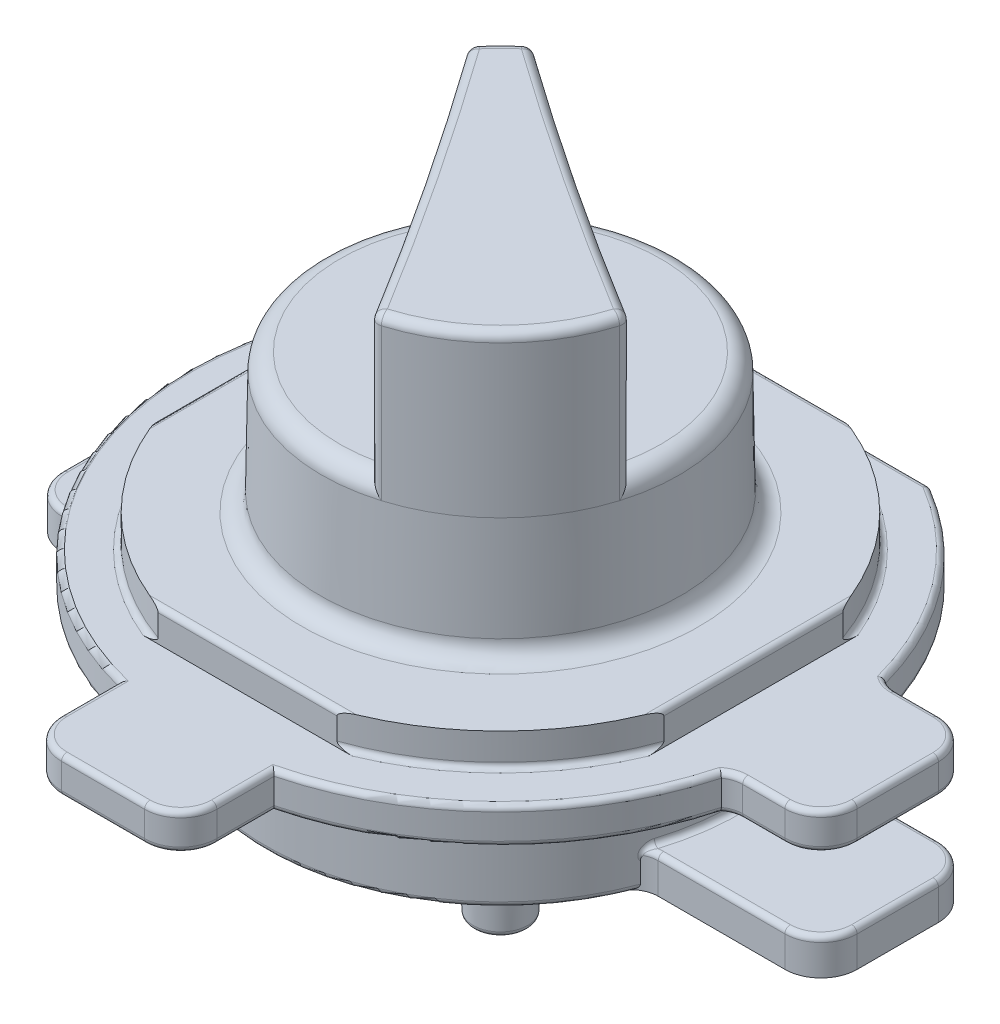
SolidWorks part; units mm, degrees
ref_plane "Face" through (0, 0, 0) normal (0, 0, 1) x (1, 0, 0)
ref_plane "Dessus" through (0, 0, 0) normal (0, 1, 0) x (1, 0, 0)
ref_plane "Droite" through (0, 0, 0) normal (1, 0, 0) x (0, 0, -1)
sketch "Esquisse1" plane through (0, 0, 0) normal (0, 0, 1) x (1, 0, 0)
  line L0 (0, 0) -> (0, 53.5931) construction
  line L1 (13, 10.1) -> (13, 15.5)
  line L2 (1.5073, 0.5361) -> (2.5181, 26)
  line L3 (13, 9.8) -> (1.875, 9.8) construction
  line L4 (17.375, 16.1) -> (17.375, 17.5)
  line L5 (17.375, 15.8) -> (13, 15.8) construction
  line L6 (11.4, 9.8) -> (12.7, 9.8)
  line L7 (13.3, 15.8) -> (17.075, 15.8)
  line L8 (14.85, 18.1) -> (14.85, 19.6)
  line L9 (15.15, 17.8) -> (17.075, 17.8)
  line L10 (9.984, 20.5838) -> (9.891, 26.3162)
  line L11 (8.8911, 27.3) -> (0, 27.3)
  line L12 (10.9839, 19.6) -> (14.85, 19.6)
  line L13 (0, 0) -> (0, 27.3)
  line L14 (11.4, 9.8) -> (11.4, 16.5)
  line L15 (8.375, 26) -> (8.375, 16.5)
  line L16 (8.375, 16.5) -> (11.4, 16.5)
  line L17 (2.5181, 26) -> (8.375, 26)
  arc A0 (1.3257, 0.2723) -> (0, 0) centre (0, 3.3639) cw
  arc A1 (1.3257, 0.2723) -> (1.5073, 0.5361) centre (1.2075, 0.548) ccw
  arc A2 (9.891, 26.3162) -> (8.8911, 27.3) centre (8.8911, 26.3) ccw
  arc A3 (9.984, 20.5838) -> (10.9839, 19.6) centre (10.9839, 20.6) ccw
  arc A4 (14.85, 18.1) -> (15.15, 17.8) centre (15.15, 18.1) ccw
  arc A5 (17.375, 17.5) -> (17.075, 17.8) centre (17.075, 17.5) ccw
  arc A6 (17.375, 16.1) -> (17.075, 15.8) centre (17.075, 16.1) cw
  arc A7 (13, 15.5) -> (13.3, 15.8) centre (13.3, 15.5) cw
  arc A8 (13, 10.1) -> (12.7, 9.8) centre (12.7, 10.1) cw
  point P9 (1.5, 0.353)
  point P21 (9.875, 27.3)
  point P24 (10, 19.6)
  point P29 (17.375, 17.8)
  dimension "D3" = 0.3
  dimension "D10" = 3.3639
  dimension "D16" = 1
  dimension "D17" = 0.3
  dimension "D1" = 3.75
  dimension "D2" = 3
  dimension "D4" = 6
  dimension "D5" = 26
  dimension "D6" = 9.8
  dimension "D7" = 2
  dimension "D8" = 34.75
  dimension "D9" = 3.3639
  dimension "D11" = 3.8
  dimension "D12" = 29.7
  dimension "D13" = 20
  dimension "D14" = 17.5
  dimension "D15" = 19.75
  dimension "D19" = 22.8
  dimension "D20" = 6.7
  dimension "D21" = 16.75
revolve "Révolution1" add sketch "Esquisse1" angle 360 about L0
sketch "Esquisse2" plane through (0, 27.3, 0) normal (0, 1, 0) x (-1, 0, 0)
  line L0 (6.994, -6.994) -> (-16.2559, 16.2559) construction
  line L1 (0, 0) -> (0, 21.3583) construction
  line L4 (-6.0345, 6.0345) -> (-9.5701, 2.499) construction
  line L5 (6.9379, -6.9379) -> (6.054, -7.8218) construction
  arc A1 (-2.8734, 9.4644) -> (-9.4644, 2.8734) centre (0, 0) ccw
  circle A9 centre (0, 0) radius 9.891 construction
  arc A10 (6.3569, -7.5777) -> (7.5777, -6.3569) centre (0, 0) ccw
  arc A11 (-9.2469, 2.3016) -> (5.7456, -7.602) centre (-144.0915, -218.1325) cw
  arc A12 (-9.2469, 2.3016) -> (-9.4644, 2.8734) centre (-8.986, 2.7281) cw
  arc A13 (5.7456, -7.602) -> (6.3569, -7.5777) centre (6.0356, -7.1946) ccw
  arc A14 (7.602, -5.7456) -> (7.5777, -6.3569) centre (7.1946, -6.0356) cw
  arc A15 (-2.3016, 9.2469) -> (-2.8734, 9.4644) centre (-2.7281, 8.986) ccw
  arc A16 (-2.3016, 9.2469) -> (7.602, -5.7456) centre (218.1325, 144.0915) ccw
  point P24 (6.2245, -6.2245)
  dimension "D1" = 0.5
  dimension "D2" = 45
  dimension "D6" = 10
extrude "Extrusion1" add sketch "Esquisse2" along normal offset from surface 25.4 and the other way up to body
fillet "Congé1" radius 0.5 8 edges at (6.994, 35.2, 6.994) (2.5504, 35.2, 9.4533) (-2.5198, 35.2, 1.6645) (-7.6942, 35.2, -6.0554) (-6.994, 35.2, -6.994) (-6.0554, 35.2, -7.6942) (1.6645, 35.2, -2.5198) (9.4533, 35.2, 2.5504)
sketch "Esquisse3" plane through (0, 26, 0) normal (0, -1, 0) x (1, 0, 0)
  arc A36 (7.6493, 3.1982) -> (-5.3928, -5.3928) centre (144.0915, -218.1325) ccw
  arc A37 (7.6493, 3.1982) -> (-5.3928, -5.3928) centre (144.0915, -218.1325) ccw
  arc A38 (-5.3928, -5.3928) -> (3.1982, 7.6493) centre (-218.1325, 144.0915) ccw
  arc A39 (-5.3928, -5.3928) -> (3.1982, 7.6493) centre (-218.1325, 144.0915) ccw
  arc A40 (7.6493, 3.1982) -> (3.1982, 7.6493) centre (0, 0) ccw
  arc A41 (7.6493, 3.1982) -> (3.1982, 7.6493) centre (0, 0) ccw
  dimension "D1" = 1.6
extrude "Enlèv. mat.-Extru.1" cut sketch "Esquisse3" against normal offset from surface (7.8 mm away) 24
sketch "Esquisse4" plane through (0, 9.8, 0) normal (0, -1, 0) x (1, 0, 0)
  line L0 (11.4, 0) -> (0, 0)
  circle A0 centre (0, 0) radius 11.4 construction
extrude "Extru.-Mince1" add sketch "Esquisse4" against normal up to body thin
pattern_circular "Répétition circulaire1" count 4 every 90 about axis through (0, 0, 0) along (0, 1, 0) of "Extru.-Mince1"
sketch "Esquisse5" plane through (0, 9.8, 0) normal (0, -1, 0) x (1, 0, 0)
  line L0 (12.9837, 4.25) -> (20, 4.25)
  line L1 (0, 0) -> (20.8329, 0) construction
  line L2 (22, 2.25) -> (22, -2.25)
  line L3 (12.9837, -4.25) -> (20, -4.25)
  line L4 (0, 0) -> (0, 22.5618) construction
  line L5 (-12.9837, -4.25) -> (-20, -4.25)
  line L6 (-22, 2.25) -> (-22, -2.25)
  line L7 (-12.9837, 4.25) -> (-20, 4.25)
  circle A0 centre (0, 0) radius 12.7 construction
  arc A1 (11.6122, -5.1426) -> (11.6122, 5.1426) centre (0, 0) ccw
  arc A2 (20, 4.25) -> (22, 2.25) centre (20, 2.25) cw
  arc A3 (12.9837, -4.25) -> (11.6122, -5.1426) centre (12.9837, -5.75) ccw
  arc A4 (12.9837, 4.25) -> (11.6122, 5.1426) centre (12.9837, 5.75) cw
  arc A5 (20, -4.25) -> (22, -2.25) centre (20, -2.25) ccw
  arc A6 (-20, -4.25) -> (-22, -2.25) centre (-20, -2.25) cw
  arc A7 (-12.9837, 4.25) -> (-11.6122, 5.1426) centre (-12.9837, 5.75) ccw
  arc A8 (-12.9837, -4.25) -> (-11.6122, -5.1426) centre (-12.9837, -5.75) cw
  arc A9 (-20, 4.25) -> (-22, 2.25) centre (-20, 2.25) ccw
  arc A10 (-11.6122, -5.1426) -> (-11.6122, 5.1426) centre (0, 0) cw
  point P10 (11.9678, -4.25)
  point P13 (11.9678, 4.25)
  point P20 (22, 0)
  point P32 (-22, 0)
  point P33 (-11.9678, 4.25)
  point P34 (-11.9678, -4.25)
  dimension "D3" = 2
  dimension "D4" = 1.5
  dimension "D1" = 8.5
  dimension "D2" = 44
extrude "Extrusion2" add sketch "Esquisse5" against normal blind 2
fillet "Congé3" radius 0.3 16 edges at (13, 11.8, 0) (12.5816, 11.8, 4.3049) (16.4919, 11.8, 4.25) (21.4142, 11.8, 3.6642) (22, 11.8, 0) (21.4142, 11.8, -3.6642) (16.4919, 11.8, -4.25) (12.5816, 11.8, -4.3049) (-13, 11.8, 0) (-21.4142, 11.8, -3.6642) (-22, 11.8, 0) (-21.4142, 11.8, 3.6642) (-16.4919, 11.8, 4.25) (-12.5816, 11.8, 4.3049) (-12.5816, 11.8, -4.3049) (-16.4919, 11.8, -4.25)
sketch "Esquisse6" plane through (0, 15.8, 0) normal (0, -1, 0) x (1, 0, 0)
  line L0 (20, 4.25) -> (12.9837, 4.25) construction
  line L1 (12.9837, -4.25) -> (20, -4.25) construction
  line L2 (22, -2.25) -> (22, 2.25) construction
  line L3 (20, 4.25) -> (17.6626, 4.25)
  line L4 (17.6626, -4.25) -> (20, -4.25)
  line L5 (22, -2.25) -> (22, 2.25)
  line L6 (-4.3, 16.5247) -> (-4.3, 20)
  line L7 (0, 0) -> (0, 20.0447) construction
  line L8 (-2.3, 22) -> (2.3, 22)
  line L9 (4.3, 16.5247) -> (4.3, 20)
  arc A0 (4.3, 16.5247) -> (-4.3, 16.5247) centre (0, 0) ccw
  arc A1 (20, -4.25) -> (22, -2.25) centre (20, -2.25) ccw construction
  arc A2 (22, 2.25) -> (20, 4.25) centre (20, 2.25) ccw construction
  circle A3 centre (0, 0) radius 17.075 construction
  arc A4 (20, -4.25) -> (22, -2.25) centre (20, -2.25) ccw
  arc A5 (22, 2.25) -> (20, 4.25) centre (20, 2.25) ccw
  arc A6 (16.2363, 5.2857) -> (17.6626, 4.25) centre (17.6626, 5.75) ccw
  arc A7 (16.2363, -5.2857) -> (17.6626, -4.25) centre (17.6626, -5.75) cw
  arc A8 (4.3, 20) -> (2.3, 22) centre (2.3, 20) ccw
  arc A10 (-4.3, 20) -> (-2.3, 22) centre (-2.3, 20) cw
  arc A11 (16.2363, -5.2857) -> (16.2363, 5.2857) centre (0, 0) ccw
  point P18 (0, 22)
  dimension "D1" = 1.5
  dimension "D3" = 2
  dimension "D2" = 8.6
extrude "Extrusion3" add sketch "Esquisse6" against normal up to surface (2 mm away)
fillet "Congé4" radius 0.3 32 edges at (21.4142, 15.8, 3.6642) (18.8313, 15.8, 4.25) (16.7813, 15.8, 4.5362) (16.7813, 15.8, -4.5362) (18.8313, 15.8, -4.25) (21.4142, 15.8, -3.6642) (22, 15.8, 0) (18.8313, 17.8, 4.25) (16.7813, 17.8, 4.5362) (16.6628, 17.7044, 4.6318) (16.6721, 15.9031, 4.6235) (16.6721, 17.6969, -4.6235) (16.7813, 17.8, -4.5362) (16.6628, 15.8956, -4.6318) (18.8313, 17.8, -4.25) (21.4142, 17.8, -3.6642) (22, 17.8, 0) (21.4142, 17.8, 3.6642) (4.3, 15.8, 18.2623) (3.7142, 15.8, 21.4142) (0, 15.8, 22) (-3.7142, 15.8, 21.4142) (-4.3, 15.8, 18.2623) (4.3, 17.2669, 16.3295) (4.3, 17.8, 18.2623) (4.3, 16.3057, 16.299) (3.7142, 17.8, 21.4142) (0, 17.8, 22) (-3.7142, 17.8, 21.4142) (-4.3, 17.8, 18.2623) (-4.3, 17.2943, 16.299) (-4.3, 16.3331, 16.3295)
sketch "Esquisse7" plane through (0, 15.8, 0) normal (0, -1, 0) x (1, 0, 0)
  line L0 (21.2556, -15) -> (-21.7879, -15)
  line L1 (-2.3, 22) -> (2.3, 22) construction
  dimension "D1" = 37
extrude "Enlèv. mat.-Extru.2" cut sketch "Esquisse7" against normal through all
sketch "Esquisse8" plane through (0, 19.6, 0) normal (0, 1, 0) x (-1, 0, 0)
  line L0 (-14, -5.7899) -> (-14, 5.7899)
  line L1 (0, 0) -> (0, 28.8138) construction
  line L2 (-5.7899, 14) -> (5.7899, 14)
  line L3 (14, 5.7899) -> (14, -5.7899)
  line L4 (5.7899, -14) -> (-5.7899, -14)
  arc A0 (2.1266, -15) -> (-2.1266, -15) centre (0, 0) ccw construction
  arc A1 (2.1266, -15) -> (5.7899, -14) centre (0, 0) ccw
  arc A2 (-14, 5.7899) -> (-14, -5.7899) centre (0, 0) ccw
  arc A3 (-5.7899, -14) -> (2.1266, -15) centre (0, 0) ccw
  arc A4 (14, -5.7899) -> (14, 5.7899) centre (0, 0) ccw
  arc A5 (5.7899, 14) -> (-5.7899, 14) centre (0, 0) ccw
  dimension "D1" = 28
extrude "Enlèv. mat.-Extru.4" cut sketch "Esquisse8" against normal up to surface (1.8 mm away)
fillet "Congé6" radius 0.3 12 edges at (0, 15.8, -15) (-8.7687, 16.8, -15) (-8.7186, 15.9796, -15) (8.6733, 15.9373, -15) (8.7687, 16.8, -15) (8.732, 17.6038, -15) (0, 17.8, -15) (-7.576, 17.37, -15) (-14, 19.6, 0) (0, 19.6, -14) (14, 19.6, 0) (0, 19.6, 14)
